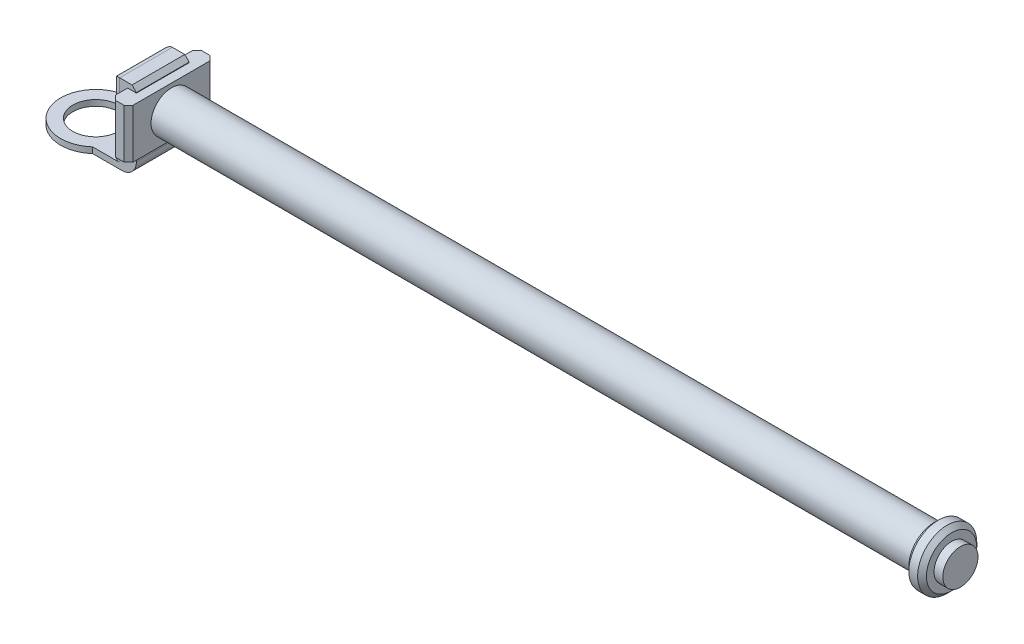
SolidWorks part; units mm, degrees
ref_plane "Front Plane" through (0, 0, 0) normal (0, 0, 1) x (1, 0, 0)
ref_plane "Top Plane" through (0, 0, 0) normal (0, 1, 0) x (1, 0, 0)
ref_plane "Right Plane" through (0, 0, 0) normal (1, 0, 0) x (0, 0, -1)
sketch "Sketch1" plane through (0, 0, 0) normal (0, 1, 0) x (1, 0, 0)
  line L1 (29.9946, 0) -> (29.9946, 9)
  line L2 (29.9946, 0) -> (29.9946, -9)
  line L3 (29.9946, -9) -> (7.9373, -9)
  line L4 (29.9946, 9) -> (7.9373, 9)
  circle A0 centre (0, 0) radius 7.8
  circle A1 centre (0, 0) radius 12
extrude "Boss-Extrude1" add sketch "Sketch1" along normal blind 2 contours A1 A0
sketch "Sketch2" plane through (0, 0, 0) normal (0, -1, 0) x (1, 0, 0)
  line L0 (7.9373, 9) -> (29.9946, 9)
  line L1 (29.9946, 9) -> (29.9946, -9)
  line L2 (29.9946, -9) -> (7.9373, -9)
  circle A0 centre (0, 0) radius 12
extrude "Boss-Extrude2" add sketch "Sketch2" against normal blind 2 contours L2 L1 L0 M2
sketch "Sketch3" plane through (0, 2, 0) normal (0, 1, 0) x (1, 0, 0)
  line L0 (0, 0) -> (11.2, 0)
  line L1 (14.6474, 9) -> (14.6474, -9)
  line L2 (29.9946, 9) -> (7.9373, 9) construction
  line L3 (7.9373, -9) -> (29.9946, -9) construction
  line L4 (14.6474, -9) -> (22.8555, -9)
  line L5 (22.8555, -9) -> (22.8555, 9)
  line L6 (22.8555, 9) -> (14.6474, 9)
extrude "Boss-Extrude3" add sketch "Sketch3" along normal blind 25 contours L5 L1 M4 M6
sketch "Sketch4" plane through (0, 2, 0) normal (0, 1, 0) x (1, 0, 0)
  line L0 (22.8555, 9) -> (29.9946, 9)
  line L1 (29.9946, 9) -> (29.9946, -9)
  line L2 (29.9946, -9) -> (22.8555, -9)
  line L3 (22.8555, -9) -> (22.8555, 9)
extrude "Cut-Extrude1" cut sketch "Sketch4" against normal blind 18
fillet "Fillet1" radius 5 1 edges at (22.8555, 0, 0)
fillet "Fillet2" radius 2.5 3 edges at (14.6474, 27, 0) (14.6474, 14.5, 9) (14.6474, 14.5, -9)
sketch "Sketch5" plane through (22.8555, 0, 0) normal (1, 0, 0) x (0, 0, -1)
  line L1 (-14.6884, 8.5117) -> (14.6884, 8.5117)
  line L2 (-14.6884, 8.5117) -> (-14.6884, 25.326)
  line L3 (-14.6884, 25.326) -> (14.6884, 25.326)
  line L4 (14.6884, 8.5117) -> (14.6884, 25.326)
  line L5 (-14.6884, 8.5117) -> (14.6884, 25.326) construction
  line L6 (-14.6884, 25.326) -> (14.6884, 8.5117) construction
  point P0 (0, 16.9188)
extrude "Boss-Extrude4" add sketch "Sketch5" against normal blind 3 and the other way blind 3
chamfer "Chamfer1" distance 1.5 angle 45 1 edges at (22.8555, 27, 0)
chamfer "Chamfer2" distance 1.5 angle 45 4 edges at (25.8555, 16.9188, 14.6884) (25.8555, 16.9188, -14.6884) (19.8555, 16.9188, -14.6884) (19.8555, 16.9188, 14.6884)
sketch "Sketch6" plane through (25.8555, 0, 0) normal (1, 0, 0) x (0, 0, -1)
  circle A0 centre (0, 16.9188) radius 7
extrude "Boss-Extrude9" add sketch "Sketch6" along normal blind 260 contours A0
sketch "Sketch13" plane through (285.8555, 0, 0) normal (1, 0, 0) x (0, 0, -1)
  circle A0 centre (0, 16.9188) radius 10.0812
extrude "Boss-Extrude13" add sketch "Sketch13" along normal blind 6
sketch "Sketch14" plane through (291.8555, 0, 0) normal (1, 0, 0) x (0, 0, -1)
  circle A0 centre (0, 16.9188) radius 6
extrude "Boss-Extrude14" add sketch "Sketch14" along normal blind 3
chamfer "Chamfer5" distance 1.5 angle 45 2 edges at (285.8555, 16.9188, -10.0812) (291.8555, 16.9188, -10.0812)
